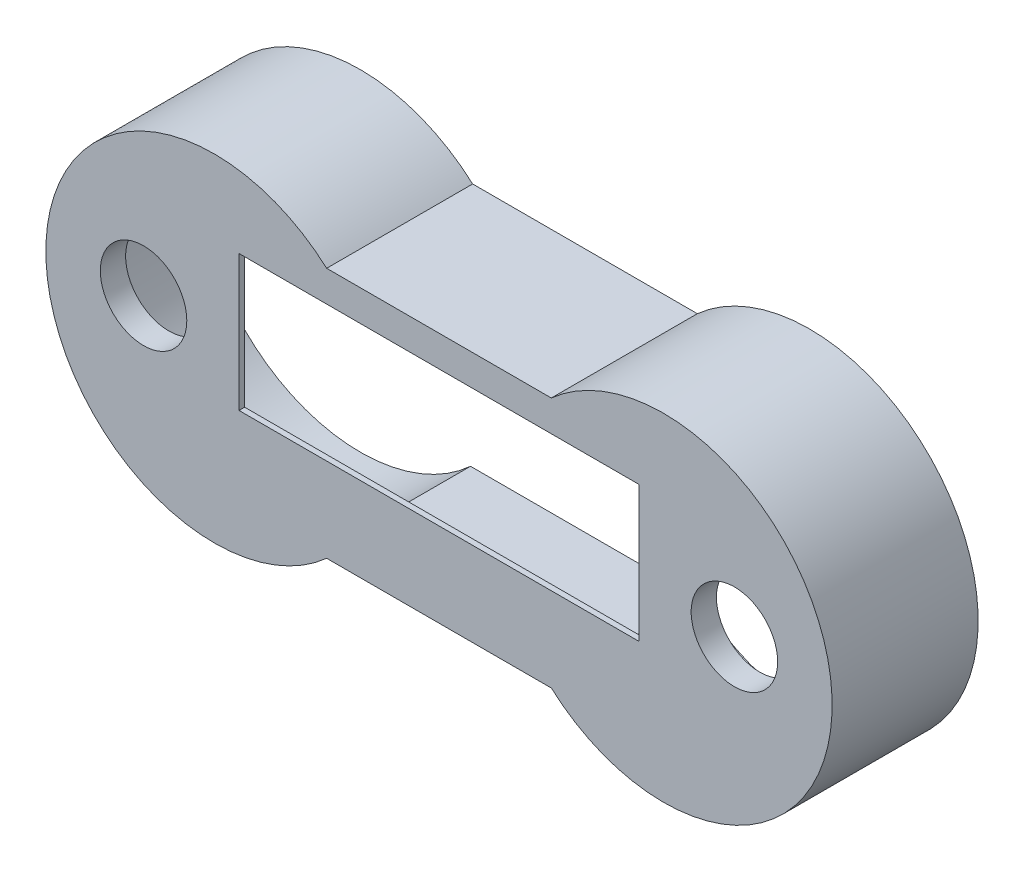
SolidWorks part; units mm, degrees
ref_plane "Plan de face" through (0, 0, 0) normal (0, 0, 1) x (1, 0, 0)
ref_plane "Plan de dessus" through (0, 0, 0) normal (0, 1, 0) x (1, 0, 0)
ref_plane "Plan de droite" through (0, 0, 0) normal (1, 0, 0) x (0, 0, -1)
sketch "Esquisse2" plane through (0, 0, 0) normal (0, 0, 1) x (1, 0, 0)
  line L0 (49.6143, 8.5) -> (90.3857, 8.5)
  line L1 (49.6143, 51.2214) -> (90.3857, 51.2214)
  line L2 (50, 7.5) -> (90, 7.5)
  line L3 (50, 52.2214) -> (90, 52.2214)
  arc A0 (50, 52.2214) -> (50, 7.5) centre (30, 29.8607) ccw
  arc A1 (90, 52.2214) -> (90, 7.5) centre (110, 29.8607) cw
  arc A2 (49.6143, 51.2214) -> (49.6143, 8.5) centre (30, 29.8607) ccw
  arc A3 (90.3857, 51.2214) -> (90.3857, 8.5) centre (110, 29.8607) cw
  dimension "D1" = 1
extrude "Boss.-Extru.1" add sketch "Esquisse2" along normal blind 25
sketch "Esquisse3" plane through (0, 0, 25) normal (0, 0, 1) x (1, 0, 0)
  line L0 (90, 52.2214) -> (50, 52.2214) construction
  line L1 (50, 7.5) -> (90, 7.5) construction
  line L2 (90, 52.2214) -> (50, 52.2214)
  line L3 (50, 7.5) -> (90, 7.5)
  arc A0 (50, 52.2214) -> (50, 7.5) centre (30, 29.8607) ccw construction
  arc A1 (90, 7.5) -> (90, 52.2214) centre (110, 29.8607) ccw construction
  arc A2 (50, 52.2214) -> (50, 7.5) centre (30, 29.8607) ccw
  arc A3 (90, 7.5) -> (90, 52.2214) centre (110, 29.8607) ccw
extrude "Boss.-Extru.2" add sketch "Esquisse3" along normal blind 1
sketch "Esquisse4" plane through (0, 0, 26) normal (0, 0, 1) x (1, 0, 0)
  line L0 (90, 52.2214) -> (50, 52.2214) construction
  line L1 (34.4, 46.7) -> (105.6, 46.7)
  line L2 (34.4, 46.7) -> (34.4, 22.5)
  line L3 (34.4, 22.5) -> (105.6, 22.5)
  line L4 (105.6, 46.7) -> (105.6, 22.5)
  line L5 (50, 7.5) -> (90, 7.5) construction
  circle A0 centre (17.4, 31.7) radius 7.7
  circle A1 centre (122.6, 31.7) radius 7.7
  point P8 (70, 52.2214)
  dimension "D3" = 15.4
  dimension "D4" = 15.4
  dimension "D1" = 71.2
  dimension "D2" = 35.6
  dimension "D5" = 15
  dimension "D6" = 24.2
  dimension "D7" = 15
  dimension "D8" = 15
  dimension "D9" = 17
  dimension "D10" = 17
extrude "Enlèv. mat.-Extru.1" cut sketch "Esquisse4" against normal through all
sketch "Esquisse5" plane through (0, 0, 25) normal (0, 0, -1) x (-1, 0, 0)
  circle A0 centre (-122.6, 31.7) radius 7.7
  circle A1 centre (-17.4, 31.7) radius 7.7
  circle A2 centre (-122.6, 31.7) radius 8.7
  circle A3 centre (-17.4, 31.7) radius 8.7
  dimension "D1" = 15.4
  dimension "D2" = 15.4
  dimension "D3" = 1
extrude "Boss.-Extru.4" add sketch "Esquisse5" along normal blind 3.5
